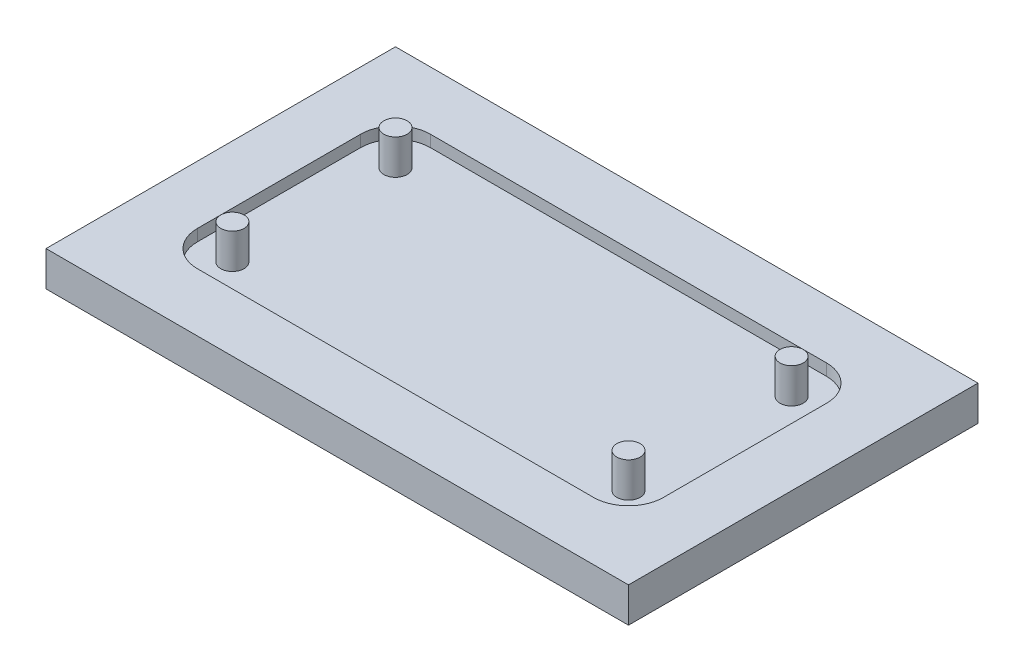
SolidWorks part; units mm, degrees
ref_plane "Front Plane" through (0, 0, 0) normal (0, 0, 1) x (1, 0, 0)
ref_plane "Top Plane" through (0, 0, 0) normal (0, 1, 0) x (1, 0, 0)
ref_plane "Right Plane" through (0, 0, 0) normal (1, 0, 0) x (0, 0, -1)
sketch "Sketch1" plane through (0, 0, 0) normal (0, 1, 0) x (1, 0, 0)
  line L1 (-85, -50) -> (85, -50)
  line L2 (-100, -35) -> (-100, 35)
  line L3 (-85, 50) -> (85, 50)
  line L4 (100, -35) -> (100, 35)
  line L5 (-100, -50) -> (100, 50) construction
  line L6 (-100, 50) -> (100, -50) construction
  arc A0 (85, 50) -> (100, 35) centre (85, 35) cw
  arc A1 (85, -50) -> (100, -35) centre (85, -35) ccw
  arc A2 (-85, -50) -> (-100, -35) centre (-85, -35) cw
  arc A3 (-100, 35) -> (-85, 50) centre (-85, 35) cw
  point P0 (0, 0)
  dimension "D1" = 15
extrude "Boss-Extrude1" add sketch "Sketch1" along normal blind 10 contours A3 L2 A2 L1 A1 L4 A0 L3
sketch "Sketch2" plane through (0, 10, 0) normal (0, 1, 0) x (1, 0, 0)
  circle A1 centre (-85, 35) radius 5
  circle A2 centre (-85, -35) radius 5
  circle A3 centre (85, 35) radius 5
  circle A4 centre (85, -35) radius 5
extrude "Boss-Extrude2" add sketch "Sketch2" along normal blind 15
sketch "Sketch3" plane through (0, 0, 0) normal (0, -1, 0) x (1, 0, 0)
  line L1 (-125, -75) -> (125, -75)
  line L2 (-125, -75) -> (-125, 75)
  line L3 (-125, 75) -> (125, 75)
  line L4 (125, -75) -> (125, 75)
  line L5 (-125, -75) -> (125, 75) construction
  line L6 (-125, 75) -> (125, -75) construction
  line L10 (-85, -50) -> (85, -50)
  line L11 (100, -35) -> (100, 35)
  line L12 (85, 50) -> (-85, 50)
  line L13 (-100, 35) -> (-100, -35)
  line L14 (-85, -50) -> (85, -50)
  line L15 (100, -35) -> (100, 35)
  line L16 (85, 50) -> (-85, 50)
  line L17 (-100, 35) -> (-100, -35)
  arc A4 (85, -50) -> (100, -35) centre (85, -35) ccw
  arc A5 (100, 35) -> (85, 50) centre (85, 35) ccw
  arc A6 (-85, 50) -> (-100, 35) centre (-85, 35) ccw
  arc A7 (-100, -35) -> (-85, -50) centre (-85, -35) ccw
  arc A8 (85, -50) -> (100, -35) centre (85, -35) ccw
  arc A9 (100, 35) -> (85, 50) centre (85, 35) ccw
  arc A10 (-85, 50) -> (-100, 35) centre (-85, 35) ccw
  arc A11 (-100, -35) -> (-85, -50) centre (-85, -35) ccw
  point P0 (0, 0)
  dimension "D1" = 0
extrude "Boss-Extrude3" add sketch "Sketch3" against normal blind 15
